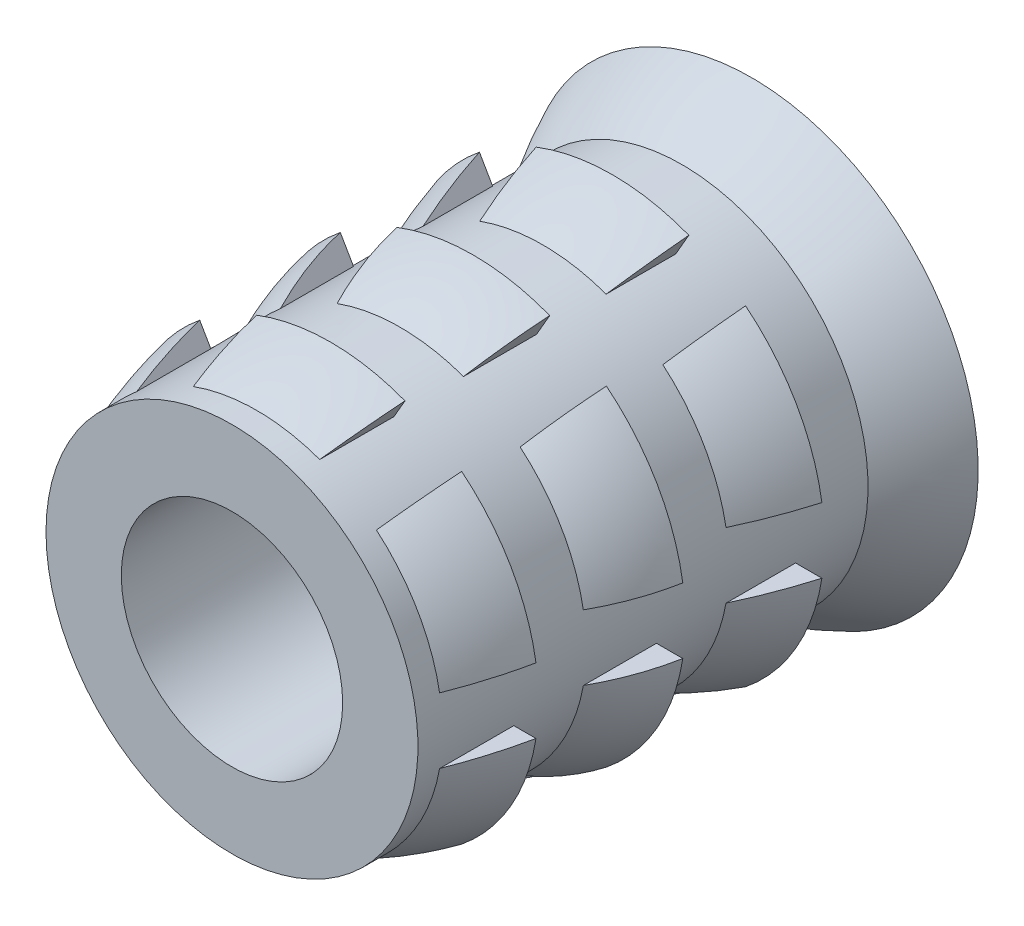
SolidWorks part; units mm, degrees
other "<insert 6-32(632S7-8)>-<CirPattern1>"
ref_plane "Front" through (0, 0, 0) normal (0, 0, 1) x (1, 0, 0)
ref_plane "Top" through (0, 0, 0) normal (0, 1, 0) x (1, 0, 0)
ref_plane "Right" through (0, 0, 0) normal (1, 0, 0) x (0, 0, -1)
inserted part "insert 6-32(632S7-8)"
